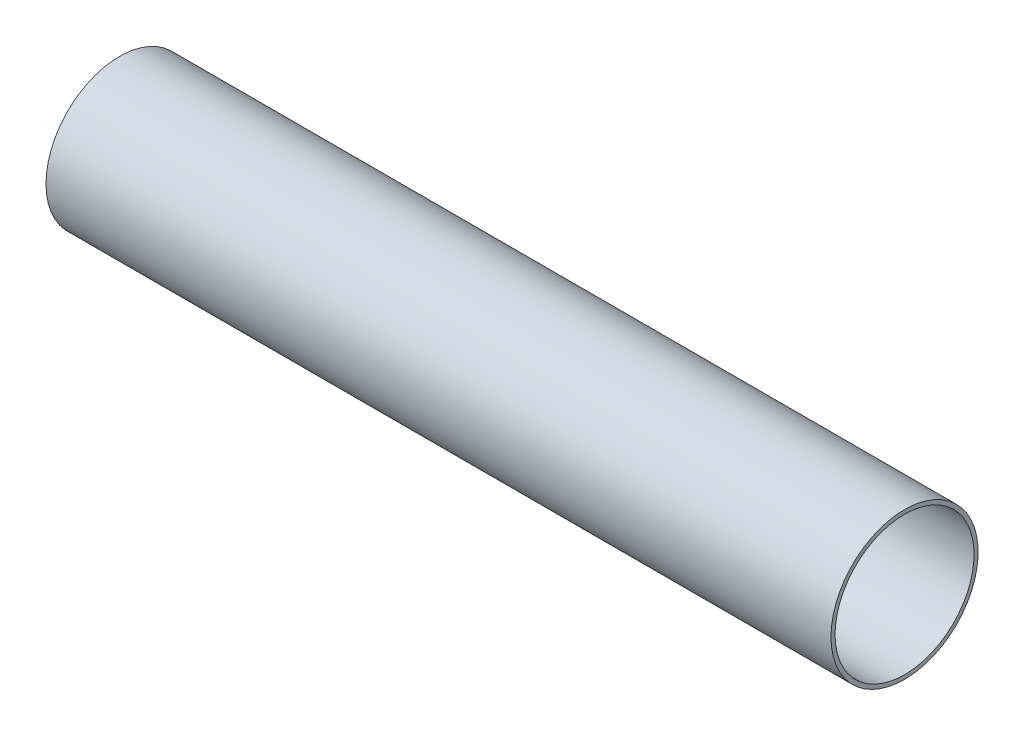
SolidWorks part; units mm, degrees
ref_plane "Front Plane" through (0, 0, 0) normal (0, 0, 1) x (1, 0, 0)
ref_plane "Top Plane" through (0, 0, 0) normal (0, 1, 0) x (1, 0, 0)
ref_plane "Right Plane" through (0, 0, 0) normal (1, 0, 0) x (0, 0, -1)
sketch "Sketch1" plane through (0, 0, 0) normal (1, 0, 0) x (0, 0, -1)
  circle A0 centre (0, 0) radius 28.575
  circle A1 centre (0, 0) radius 26.9875
  dimension "D1" = 57.15
  dimension "D2" = 53.975
extrude "Extrude1" add sketch "Sketch1" along normal blind 304.8
